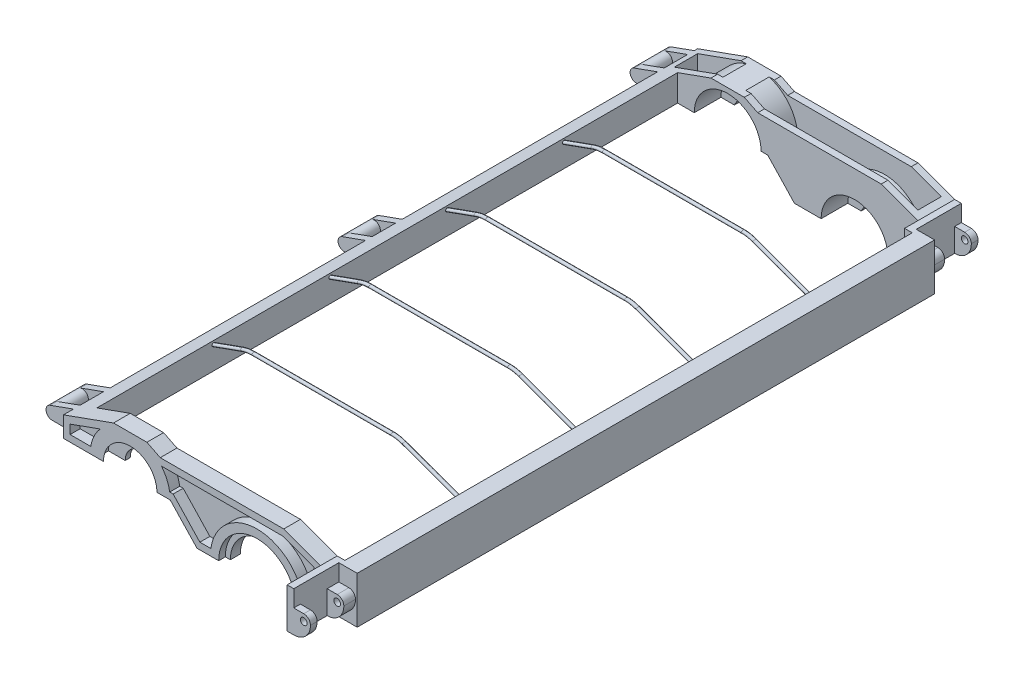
SolidWorks part; units mm, degrees
ref_plane "Face" through (0, 0, 0) normal (0, 0, 1) x (1, 0, 0)
ref_plane "Dessus" through (0, 0, 0) normal (0, 1, 0) x (1, 0, 0)
ref_plane "Droite" through (0, 0, 0) normal (1, 0, 0) x (0, 0, -1)
sketch "Esquisse1" plane through (0, 0, 0) normal (0, 0, 1) x (1, 0, 0)
  line L0 (-67, 38.5) -> (-82, 38.5)
  line L1 (-5, 30) -> (-14, 30)
  line L2 (-5, 30) -> (-5, 44)
  line L3 (-5, 44) -> (-16, 48)
  line L4 (-16, 48) -> (-53, 48)
  line L5 (-16, 48) -> (-5, 48) construction
  line L6 (-5, 48) -> (-5, 44) construction
  line L7 (-82, 44.6098) -> (-82, 38.5)
  line L10 (-53, 48) -> (-57, 50)
  line L11 (-57, 50) -> (-67, 50)
  line L12 (-67, 50) -> (-82, 44.6098)
  line L13 (-34, 30) -> (-42, 30)
  line L14 (-42, 30) -> (-50, 38.5)
  line L15 (-50, 38.5) -> (-57, 38.5)
  arc A2 (-57, 38.5) -> (-67, 38.5) centre (-62, 38.5) ccw
  arc A3 (-14, 30) -> (-34, 30) centre (-24, 30) ccw
  dimension "D8" = 38.5
  dimension "D13" = 53
  dimension "D19" = 10
  dimension "D20" = 20
  dimension "D3" = 30
  dimension "D4" = 11
  dimension "D5" = 4
  dimension "D6" = 48
  dimension "D7" = 50
  dimension "D9" = 24
  dimension "D10" = 62
  dimension "D11" = 5
  dimension "D12" = 4
  dimension "D14" = 19.766
  dimension "D15" = 10
  dimension "D16" = 12
  dimension "D17" = 18
  dimension "D18" = 20
extrude "Bord avant" add sketch "Esquisse1" against normal blind 5
sketch "Esquisse3" plane through (0, 0, 0) normal (0, 0, 1) x (1, 0, 0)
  line L13 (-80, 43.2033) -> (-80, 40.5)
  line L14 (-80, 43.2033) -> (-80, 40.5)
  line L22 (-55.2918, 40.5) -> (-49.1359, 40.5)
  line L23 (-49.1359, 40.5) -> (-41.1359, 32)
  line L24 (-41.1359, 32) -> (-35.8322, 32)
  line L25 (-12.1678, 32) -> (-7, 32)
  line L26 (-7, 32) -> (-7, 42.5991)
  line L27 (-7, 42.5991) -> (-16.3523, 46)
  line L28 (-16.3523, 46) -> (-53.4721, 46)
  line L29 (-53.4721, 46) -> (-57.4721, 48)
  line L30 (-57.4721, 48) -> (-66.6516, 48)
  line L31 (-66.6516, 48) -> (-80, 43.2033)
  line L32 (-80, 40.5) -> (-68.7082, 40.5)
  line L33 (-50.1678, 40.5) -> (-49.1359, 40.5)
  line L34 (-49.1359, 40.5) -> (-41.1359, 32)
  line L35 (-41.1359, 32) -> (-37.8564, 32)
  line L36 (-10.1436, 32) -> (-7, 32)
  line L37 (-7, 32) -> (-7, 42.5991)
  line L38 (-7, 42.5991) -> (-16.3523, 46)
  line L39 (-16.3523, 46) -> (-52.6325, 46)
  line L42 (-70.9998, 46.4375) -> (-80, 43.2033)
  line L43 (-80, 40.5) -> (-73.8322, 40.5)
  arc A2 (-10.1436, 32) -> (-37.8564, 32) centre (-24, 30) ccw
  arc A3 (-50.1678, 40.5) -> (-52.6325, 46) centre (-62, 38.5) ccw
  arc A4 (-55.2918, 40.5) -> (-68.7082, 40.5) centre (-62, 38.5) ccw
  arc A5 (-12.1678, 32) -> (-35.8322, 32) centre (-24, 30) ccw
  arc A6 (-70.9998, 46.4375) -> (-73.8322, 40.5) centre (-62, 38.5) ccw
  dimension "D2" = 14
  dimension "D3" = 12
  dimension "D1" = 2
extrude "Evidements" cut sketch "Esquisse3" against normal blind 3
sketch "Esquisse4" plane through (0, 0, 0) normal (0, 0, 1) x (1, 0, 0)
  circle A0 centre (-24, 30) radius 11.5
  dimension "D1" = 23
extrude "Lamage Grande roue" cut sketch "Esquisse4" against normal blind 2
sketch "Esquisse5" plane through (0, 38.5, 0) normal (0, -1, 0) x (1, 0, 0)
  line L0 (-62, 0) -> (-62, -5) construction
  line L1 (-57, 0) -> (-67, 0) construction
  line L2 (-67, -5) -> (-57, -5) construction
  line L5 (-57, 0) -> (-57, -3.5)
  line L6 (-57, -3.5) -> (-52, -3.5)
  line L7 (-52, -1.5) -> (-52, -3.5)
  line L8 (-57, -5) -> (-50, -5) construction
  line L10 (-54, 0) -> (-52.5, -1.5)
  line L11 (-57, 0) -> (-50, 0) construction
  line L13 (-52.5, -1.5) -> (-52, -1.5)
  line L14 (-54, 0) -> (-57, 0)
  dimension "D1" = 20
  dimension "D2" = 2
  dimension "D3" = 1.5
  dimension "D4" = 16
  dimension "D5" = 45
revolve "Lamage moyenne roue" cut sketch "Esquisse5" angle 360 about L0
sketch "Esquisse12" plane through (0, 0, -5) normal (0, 0, -1) x (-1, 0, 0)
  line L1 (5, 30) -> (-2.5, 30)
  line L2 (5, 30) -> (5, 44)
  line L3 (5, 44) -> (-2.5, 44)
  line L4 (-2.5, 30) -> (-2.5, 44)
  dimension "D1" = 7.5
extrude "Mur clip" add sketch "Esquisse12" against normal blind 1.5
sketch "Esquisse9" plane through (0, 0, -3.5) normal (0, 0, 1) x (1, 0, 0)
  line L1 (0, 39) -> (-3, 39)
  line L2 (-3, 39) -> (-3, 44)
  line L10 (-3, 44) -> (-5, 44)
  line L11 (-5, 30) -> (-5, 44) construction
  line L12 (-3, 32) -> (-5, 32)
  line L13 (-5, 32) -> (-5, 44)
  line L16 (-5, 44) -> (2.5, 44) construction
  arc A0 (-3, 32) -> (2, 37) centre (-3, 37) ccw
  arc A1 (2, 37) -> (0, 39) centre (0, 37) ccw
  circle A2 centre (0, 37) radius 1
  dimension "D4" = 2
  dimension "D5" = 2
  dimension "D1" = 5
  dimension "D2" = 7
  dimension "D3" = 2
extrude "Plaque clip" add sketch "Esquisse9" along normal blind 13.5
sketch "Esquisse13" plane through (0, 44, 0) normal (0, 1, 0) x (-1, 0, 0)
  line L0 (3, 10) -> (3, -3.5) construction
  line L1 (3, 8) -> (-2.5, 8)
  line L2 (3, 8) -> (3, 0)
  line L3 (3, 0) -> (-2.5, 0)
  line L4 (-2.5, 8) -> (-2.5, 0)
  line L5 (-2.5, -3.5) -> (-2.5, -5) construction
  line L6 (3, 10) -> (5, 10) construction
  line L7 (5, 0) -> (16, 0) construction
  dimension "D1" = 2
extrude "Rainure clip" cut sketch "Esquisse13" against normal through all
sketch "Esquisse6" plane through (0, 0, -5) normal (0, 0, -1) x (-1, 0, 0)
  line L0 (-2.5, 44) -> (2.6869, 44)
  line L1 (-2.5, 44) -> (-2.5, 30)
  line L2 (-2.5, 30) -> (-1.5, 30)
  line L7 (14, 30) -> (-2.5, 30) construction
  line L8 (-2.5, 44) -> (-2.5, 30) construction
  line L9 (5, 44) -> (-2.5, 44) construction
  arc A0 (2.6869, 44) -> (-1.5, 30) centre (24, 30) ccw
  arc A2 (34, 30) -> (14, 30) centre (24, 30) ccw construction
  dimension "D1" = 1
extrude "Ramasse miette" add sketch "Esquisse6" along normal blind 170
ref_plane "Plan1" through (0, 0, -90) normal (0, 0, -1) x (-1, 0, 0)
mirror "Symétrie palier clip" about plane through (0, 0, -90) normal (0, 0, -1)
ref_plane "Plan2" through (0, 0, -179) normal (0, 0, -1) x (-1, 0, 0)
sketch "Esquisse14" plane through (0, 0, -179) normal (0, 0, -1) x (-1, 0, 0)
  line L0 (5, 44) -> (5, 32) construction
  line L1 (5, 44) -> (5, 32)
  line L2 (5, 30) -> (5, 32) construction
  line L3 (5, 30) -> (5, 32)
  line L4 (14, 30) -> (-1.5, 30) construction
  line L5 (14, 30) -> (5, 30)
  line L12 (-1.5, 30) -> (14, 30)
  line L13 (34, 30) -> (42, 30)
  line L14 (42, 30) -> (50, 38.5)
  line L15 (50, 38.5) -> (57, 38.5)
  line L16 (67, 38.5) -> (82, 38.5)
  line L17 (82, 38.5) -> (82, 44.6098)
  line L18 (82, 44.6098) -> (67, 50)
  line L19 (67, 50) -> (57, 50)
  line L20 (57, 50) -> (53, 48)
  line L21 (53, 48) -> (16, 48)
  line L22 (16, 48) -> (5, 44)
  line L23 (5, 44) -> (2.6869, 44)
  line L25 (34, 30) -> (42, 30)
  line L26 (42, 30) -> (50, 38.5)
  line L27 (50, 38.5) -> (52, 38.5)
  line L28 (72, 38.5) -> (82, 38.5)
  line L29 (82, 38.5) -> (82, 44.6098)
  line L30 (82, 44.6098) -> (67, 50)
  line L31 (67, 50) -> (57, 50)
  line L32 (57, 50) -> (53, 48)
  line L33 (53, 48) -> (16, 48)
  line L34 (16, 48) -> (5, 44)
  arc A0 (72, 38.5) -> (52, 38.5) centre (62, 38.5) ccw
  arc A1 (67, 38.5) -> (57, 38.5) centre (62, 38.5) ccw construction
  arc A3 (2.6869, 44) -> (-1.5, 30) centre (24, 30) ccw
  arc A4 (34, 30) -> (14, 30) centre (24, 30) ccw
  arc A5 (67, 38.5) -> (57, 38.5) centre (62, 38.5) ccw
  arc A7 (34, 30) -> (14, 30) centre (24, 30) ccw
  dimension "D2" = 10
  dimension "D1" = 0
extrude "Plaque arrière" add sketch "Esquisse14" along normal blind 2
sketch "Esquisse15" plane through (0, 0, -5) normal (0, 0, -1) x (-1, 0, 0)
  line L0 (77, 46.4065) -> (77, 38.5)
  line L12 (-1.5, 30) -> (14, 30)
  line L13 (34, 30) -> (42, 30)
  line L14 (42, 30) -> (50, 38.5)
  line L15 (50, 38.5) -> (57, 38.5)
  line L16 (67, 38.5) -> (82, 38.5)
  line L17 (82, 38.5) -> (82, 44.6098)
  line L18 (82, 44.6098) -> (67, 50)
  line L19 (67, 50) -> (57, 50)
  line L20 (57, 50) -> (53, 48)
  line L21 (53, 48) -> (16, 48)
  line L22 (16, 48) -> (5, 44)
  line L23 (5, 44) -> (2.6869, 44)
  line L28 (77, 38.5) -> (82, 38.5)
  line L29 (82, 38.5) -> (82, 44.6098)
  line L30 (82, 44.6098) -> (77, 46.4065)
  arc A3 (2.6869, 44) -> (-1.5, 30) centre (24, 30) ccw
  arc A4 (34, 30) -> (14, 30) centre (24, 30) ccw
  arc A5 (67, 38.5) -> (57, 38.5) centre (62, 38.5) ccw
  dimension "D2" = 5
  dimension "D1" = 0
extrude "Barre frontale" add sketch "Esquisse15" along normal up to next
sketch "Esquisse16" plane through (0, 0, -181) normal (0, 0, -1) x (-1, 0, 0)
  line L0 (80, 40.5) -> (80, 45.3285)
  line L1 (73.8322, 40.5) -> (80, 40.5)
  line L2 (49.1359, 40.5) -> (50.1678, 40.5)
  line L3 (41.1359, 32) -> (49.1359, 40.5)
  line L4 (35.8322, 32) -> (41.1359, 32)
  line L5 (7, 32) -> (12.1678, 32)
  line L6 (7, 44.7273) -> (7, 32)
  line L7 (82, 44.6098) -> (67, 50) construction
  line L8 (82, 44.6098) -> (80, 45.3285)
  line L9 (16, 48) -> (5, 44) construction
  line L10 (7, 44.7273) -> (5, 44)
  line L11 (67, 50) -> (57, 50) construction
  line L12 (65.4278, 50) -> (58.5722, 50)
  line L13 (5, 30) -> (14, 30)
  line L14 (34, 30) -> (42, 30)
  line L15 (42, 30) -> (50, 38.5)
  line L16 (50, 38.5) -> (52, 38.5)
  line L17 (72, 38.5) -> (82, 38.5)
  line L18 (82, 38.5) -> (82, 44.6098)
  line L19 (82, 44.6098) -> (67, 50)
  line L20 (67, 50) -> (57, 50)
  line L21 (57, 50) -> (53, 48)
  line L22 (53, 48) -> (16, 48)
  line L23 (16, 48) -> (5, 44)
  line L24 (5, 44) -> (5, 32)
  line L25 (5, 32) -> (5, 30)
  line L26 (5, 30) -> (14, 30)
  line L27 (34, 30) -> (42, 30)
  line L28 (42, 30) -> (50, 38.5)
  line L29 (50, 38.5) -> (52, 38.5)
  line L30 (72, 38.5) -> (82, 38.5)
  line L31 (82, 38.5) -> (82, 44.6098)
  line L37 (5, 44) -> (5, 32)
  line L38 (5, 32) -> (5, 30)
  arc A0 (73.8322, 40.5) -> (65.4278, 50) centre (62, 38.5) ccw
  arc A1 (35.8322, 32) -> (12.1678, 32) centre (24, 30) ccw
  arc A2 (34, 30) -> (14, 30) centre (24, 30) ccw
  arc A3 (72, 38.5) -> (52, 38.5) centre (62, 38.5) ccw
  arc A4 (34, 30) -> (14, 30) centre (24, 30) ccw
  arc A5 (72, 38.5) -> (52, 38.5) centre (62, 38.5) ccw
  arc A6 (58.5722, 50) -> (50.1678, 40.5) centre (62, 38.5) ccw
  dimension "D1" = 0
  dimension "D2" = 2
extrude "Entretoise arrière" add sketch "Esquisse16" along normal blind 7
sketch "Esquisse17" plane through (0, 0, -188) normal (0, 0, -1) x (-1, 0, 0)
  line L0 (80, 45.3285) -> (67, 50) construction
  line L1 (80, 45.3285) -> (67, 50)
  line L2 (65.4278, 50) -> (58.5722, 50) construction
  line L3 (65.4278, 50) -> (58.5722, 50)
  line L4 (67, 50) -> (65.4278, 50) construction
  line L5 (67, 50) -> (65.4278, 50)
  line L6 (58.5722, 50) -> (57, 50) construction
  line L7 (58.5722, 50) -> (57, 50)
  line L8 (57, 50) -> (53, 48) construction
  line L9 (57, 50) -> (53, 48)
  line L10 (53, 48) -> (16, 48) construction
  line L11 (53, 48) -> (16, 48)
  line L12 (16, 48) -> (7, 44.7273) construction
  line L13 (16, 48) -> (7, 44.7273)
  line L14 (72, 38.5) -> (68, 38.5)
  line L15 (68, 38.5) -> (65, 43.6962)
  line L16 (65, 43.6962) -> (59, 43.6962)
  line L17 (59, 43.6962) -> (56, 38.5)
  line L18 (5, 44) -> (5, 32)
  line L19 (5, 32) -> (5, 30)
  line L20 (5, 30) -> (14, 30)
  line L21 (34, 30) -> (42, 30)
  line L22 (42, 30) -> (50, 38.5)
  line L23 (50, 38.5) -> (52, 38.5)
  line L24 (72, 38.5) -> (82, 38.5)
  line L25 (82, 38.5) -> (82, 44.6098)
  line L26 (82, 44.6098) -> (80, 45.3285)
  line L27 (80, 45.3285) -> (80, 40.5)
  line L28 (80, 40.5) -> (73.8322, 40.5)
  line L29 (65.4278, 50) -> (58.5722, 50)
  line L30 (50.1678, 40.5) -> (49.1359, 40.5)
  line L31 (49.1359, 40.5) -> (41.1359, 32)
  line L32 (41.1359, 32) -> (35.8322, 32)
  line L33 (12.1678, 32) -> (7, 32)
  line L34 (7, 32) -> (7, 44.7273)
  line L35 (7, 44.7273) -> (5, 44)
  line L36 (5, 44) -> (5, 32)
  line L37 (5, 32) -> (5, 30)
  line L38 (5, 30) -> (14, 30)
  line L39 (34, 30) -> (42, 30)
  line L40 (42, 30) -> (50, 38.5)
  line L41 (50, 38.5) -> (52, 38.5)
  line L42 (72, 38.5) -> (82, 38.5)
  line L43 (82, 38.5) -> (82, 44.6098)
  line L44 (82, 44.6098) -> (80, 45.3285)
  line L45 (30, 30) -> (34, 30)
  line L46 (56, 38.5) -> (57.5, 35.9019)
  line L47 (59, 33.3038) -> (62, 33.3038)
  line L48 (56, 38.5) -> (52, 38.5)
  line L49 (66.5, 35.9019) -> (68, 38.5)
  line L50 (30, 30) -> (27, 35.1962)
  line L51 (27, 35.1962) -> (21, 35.1962)
  line L52 (21, 35.1962) -> (18, 30)
  line L53 (7, 44.7273) -> (5, 44)
  line L55 (18, 30) -> (19.5, 27.4019)
  line L56 (21, 24.8038) -> (24, 24.8038)
  line L57 (14, 30) -> (18, 30)
  line L58 (28.5, 27.4019) -> (30, 30)
  circle A0 centre (62, 38.5) radius 5.1962 construction
  circle A1 centre (24, 30) radius 5.1962 construction
  arc A5 (34, 30) -> (14, 30) centre (24, 30) ccw
  arc A6 (72, 38.5) -> (52, 38.5) centre (62, 38.5) ccw
  arc A7 (73.8322, 40.5) -> (65.4278, 50) centre (62, 38.5) ccw
  arc A8 (58.5722, 50) -> (50.1678, 40.5) centre (62, 38.5) ccw
  arc A9 (35.8322, 32) -> (12.1678, 32) centre (24, 30) ccw
  dimension "D2" = 12
  dimension "D3" = 12
  dimension "D1" = 0
extrude "Deuxième plaque arrière" add sketch "Esquisse17" along normal blind 2
sketch "Esquisse18" plane through (0, 0, -188) normal (0, 0, 1) x (1, 0, 0)
  line L5 (-34, 30) -> (-30, 30)
  line L6 (-30, 30) -> (-27, 35.1962)
  line L7 (-27, 35.1962) -> (-21, 35.1962)
  line L8 (-21, 35.1962) -> (-18, 30)
  line L9 (-18, 30) -> (-14, 30)
  line L10 (-34, 30) -> (-30, 30)
  line L11 (-30, 30) -> (-27, 35.1962)
  line L12 (-27, 35.1962) -> (-21, 35.1962)
  line L13 (-21, 35.1962) -> (-18, 30)
  line L14 (-18, 30) -> (-14, 30)
  line L15 (-72, 38.5) -> (-68, 38.5)
  line L16 (-68, 38.5) -> (-65, 43.6962)
  line L17 (-65, 43.6962) -> (-59, 43.6962)
  line L18 (-59, 43.6962) -> (-56, 38.5)
  line L19 (-56, 38.5) -> (-52, 38.5)
  line L20 (-72, 38.5) -> (-68, 38.5)
  line L21 (-68, 38.5) -> (-65, 43.6962)
  line L22 (-65, 43.6962) -> (-59, 43.6962)
  line L23 (-59, 43.6962) -> (-56, 38.5)
  line L24 (-56, 38.5) -> (-52, 38.5)
  arc A1 (-14, 30) -> (-34, 30) centre (-24, 30) ccw
  arc A2 (-14, 30) -> (-34, 30) centre (-24, 30) ccw
  arc A3 (-52, 38.5) -> (-72, 38.5) centre (-62, 38.5) ccw
  arc A4 (-52, 38.5) -> (-72, 38.5) centre (-62, 38.5) ccw
  dimension "D1" = 0
  dimension "D2" = 0
extrude "Epaississement hexagones" add sketch "Esquisse18" along normal blind 1
sketch "Esquisse19" plane through (0, 0, -190) normal (0, 0, -1) x (-1, 0, 0)
  line L0 (5, 30) -> (18, 30) construction
  line L1 (31.5, 30) -> (30, 30)
  line L2 (30, 30) -> (29.134, 31.5)
  line L3 (27, 35.1962) -> (30, 30) construction
  line L4 (29.134, 31.5) -> (18.866, 31.5)
  line L5 (18, 30) -> (21, 35.1962) construction
  line L6 (18.866, 31.5) -> (18, 30)
  line L7 (18, 30) -> (16.5, 30)
  line L8 (68, 38.5) -> (82, 38.5) construction
  line L9 (69.5, 38.5) -> (68, 38.5)
  line L10 (68, 38.5) -> (67.134, 40)
  line L11 (65, 43.6962) -> (68, 38.5) construction
  line L12 (67.134, 40) -> (56.866, 40)
  line L13 (56, 38.5) -> (59, 43.6962) construction
  line L14 (56.866, 40) -> (56, 38.5)
  line L15 (56, 38.5) -> (54.5, 38.5)
  line L16 (50, 38.5) -> (56, 38.5) construction
  arc A0 (16.5, 30) -> (31.5, 30) centre (24, 30) cw
  arc A1 (54.5, 38.5) -> (69.5, 38.5) centre (62, 38.5) cw
  dimension "D1" = 7.5
  dimension "D4" = 7.5
  dimension "D2" = 1.5
  dimension "D3" = 1.5
extrude "Caches hexagones" add sketch "Esquisse19" along normal blind 1
ref_plane "Plan clip" through (0, 0, -8.5) normal (0, 0, 1) x (1, 0, 0)
sketch "Esquisse20" plane through (0, 0, -8.5) normal (0, 0, 1) x (1, 0, 0)
  line L0 (-82, 44.6098) -> (-89.0093, 42.091)
  line L1 (-88.3836, 38.5) -> (-82, 38.5)
  line L2 (-67, 50) -> (-82, 44.6098) construction
  line L3 (-82, 38.5) -> (-70, 38.5) construction
  line L4 (-82, 44.6098) -> (-82, 38.5)
  arc A0 (-89.0093, 42.091) -> (-88.3836, 38.5) centre (-88.3836, 40.35) ccw
  dimension "D1" = 1.85
extrude "Clip boitier" add sketch "Esquisse20" against normal mid plane 11
sketch "Esquisse21" plane through (0, 0, -8.5) normal (0, 0, 1) x (1, 0, 0)
  line L0 (-89.0093, 42.091) -> (-82, 44.6098)
  line L1 (-82, 44.6098) -> (-82, 40.5)
  line L2 (-82, 44.6098) -> (-82, 38.5) construction
  line L3 (-82, 40.5) -> (-80, 38.5)
  line L4 (-82, 38.5) -> (-70, 38.5) construction
  line L5 (-80, 38.5) -> (-88.3836, 38.5)
  line L6 (-82, 44.6098) -> (-89.0093, 42.091) construction
  line L7 (-80, 40.5) -> (-73.8322, 40.5) construction
  arc A0 (-89.0093, 42.091) -> (-88.3836, 38.5) centre (-88.3836, 40.35) cw
  arc A1 (-89.0093, 42.091) -> (-88.3836, 38.5) centre (-88.3836, 40.35) ccw construction
  dimension "D1" = 45
extrude "Enlèv. mat.-Extru.1" cut sketch "Esquisse21" against normal mid plane 7
pattern_linear "Répétition linéaire1" count 3 spacing 87.5
ref_plane "Plan grille" through (0, 0, -40) normal (0, 0, -1) x (-1, 0, 0)
sketch "Guide grille" plane through (0, 0, -40) normal (0, 0, -1) x (-1, 0, 0)
  line L0 (77, 45.3439) -> (68.4653, 48.4108)
  line L1 (65.0836, 49) -> (23.4379, 49)
  line L2 (20.0205, 48.3979) -> (-0.5, 40.9359)
  line L3 (77, 46.4065) -> (77, 38.5) construction
  line L4 (82, 44.6098) -> (67, 50) construction
  line L6 (53, 48) -> (16, 48) construction
  line L7 (16, 48) -> (5, 44) construction
  line L8 (16, 48) -> (53, 48) construction
  line L9 (-2.5, 44) -> (-2.5, 30) construction
  arc A1 (68.4653, 48.4108) -> (65.0836, 49) centre (65.0836, 39) ccw
  arc A2 (23.4379, 49) -> (20.0205, 48.3979) centre (23.4379, 39) ccw
  dimension "D6" = 10
  dimension "D1" = 1
  dimension "D2" = 1
  dimension "D3" = 2
  dimension "D4" = 1
sketch "Rond grille" plane through (-77, 0, 0) normal (1, 0, 0) x (0, 0, -1)
  circle A0 centre (40, 45.3439) radius 0.5
  dimension "D1" = 1
sweep "Balayage1" add profiles "Rond grille" path "Guide grille"
pattern_linear "Répétition linéaire2" count 4 spacing 35
